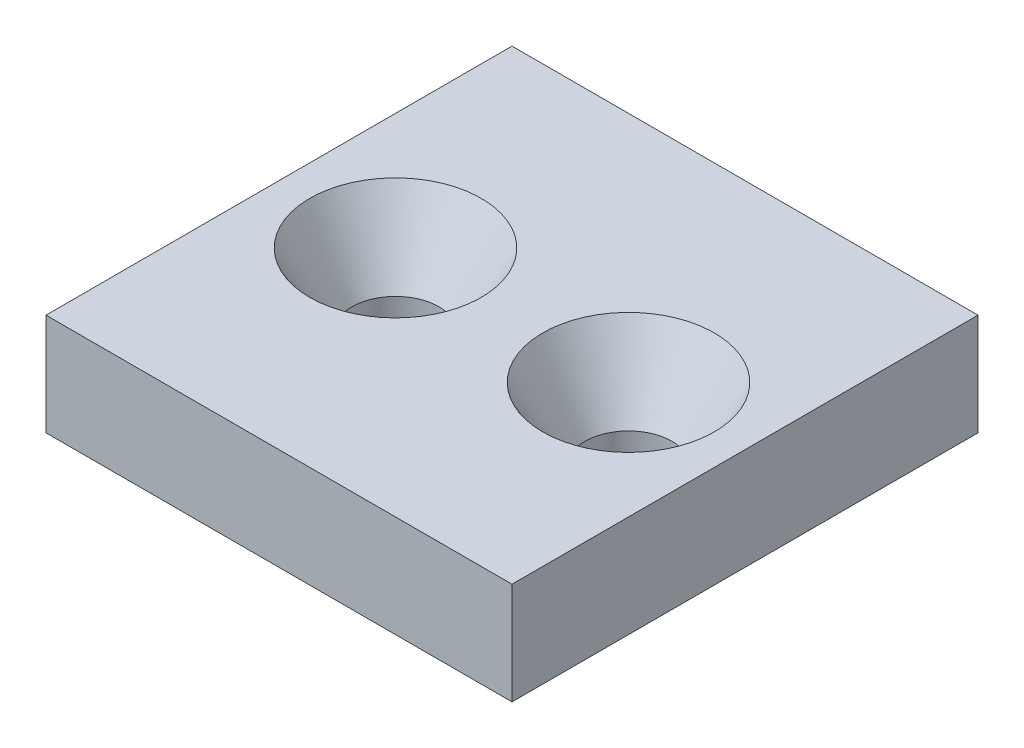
SolidWorks part; units mm, degrees
ref_plane "Front Plane" through (0, 0, 0) normal (0, 0, 1) x (1, 0, 0)
ref_plane "Top Plane" through (0, 0, 0) normal (0, 1, 0) x (1, 0, 0)
ref_plane "Right Plane" through (0, 0, 0) normal (1, 0, 0) x (0, 0, -1)
sketch "Sketch1" plane through (0, 0, 0) normal (0, 1, 0) x (1, 0, 0)
  line L1 (-16, -16) -> (16, -16)
  line L2 (-16, -16) -> (-16, 16)
  line L3 (-16, 16) -> (16, 16)
  line L4 (16, -16) -> (16, 16)
  line L5 (-16, -16) -> (16, 16) construction
  line L6 (-16, 16) -> (16, -16) construction
  point P0 (0, 0)
  dimension "D1" = 32
extrude "Boss-Extrude1" add sketch "Sketch1" along normal blind 7
hole_wizard "CSK for M6 Flat Head Machine Screw1" positions "Sketch3" profile "Sketch2" countersink size "M6" standard "Ansi Metric"
sketch "Sketch3" plane through (0, 7, 0) normal (0, 1, 0) x (-1, 0, 0)
  line L0 (-16, 16) -> (-16, -16) construction
  point P0 (8, 0)
  point P1 (-8, 0)
  dimension "D1" = 8
  dimension "D2" = 16
sketch "Sketch2" plane through (-8, 7, 0) normal (1, 0, 0) x (0, 0, 1)
  line L0 (0, 0) -> (0, 7)
  line L1 (0, 7) -> (3, 7)
  line L2 (3, 7) -> (3, 5.0056)
  line L3 (3, 5.0056) -> (5.89, 0)
  line L5 (5.89, 0) -> (0, 0)
  line L6 (-3, 5.0056) -> (-5.89, 0) construction
  line L11 (0, -6.35) -> (0, 107.95) construction
  dimension "Thru Hole Dia." = 6
  dimension "Thru Hole Depth" = 7
  dimension "Near C'Sink Dia." = 11.78
  dimension "Near C'Sink Angle" = 60
